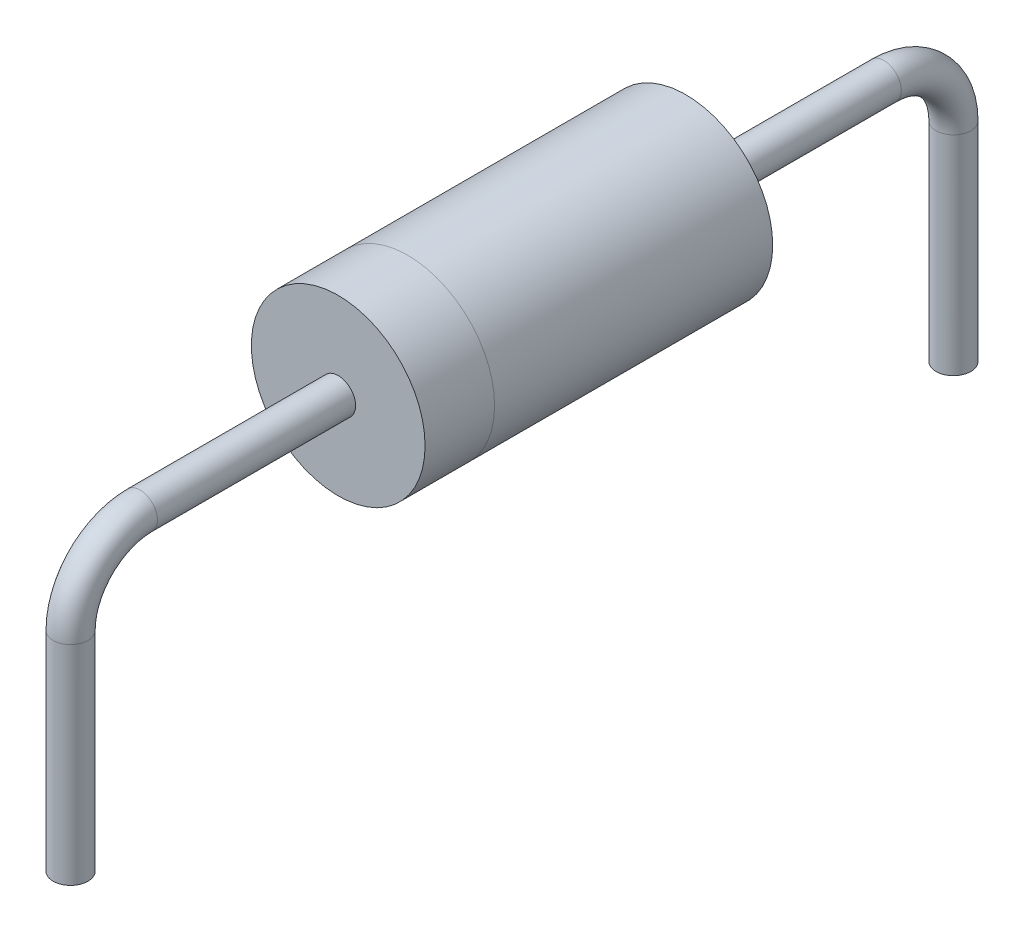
SolidWorks part; units mm, degrees
ref_plane "Plan de face" through (0, 0, 0) normal (0, 0, 1) x (1, 0, 0)
ref_plane "Plan de dessus" through (0, 0, 0) normal (0, 1, 0) x (1, 0, 0)
ref_plane "Plan de droite" through (0, 0, 0) normal (1, 0, 0) x (0, 0, -1)
sketch "Esquisse1" plane through (0, 0, 0) normal (0, 0, 1) x (1, 0, 0)
  circle A0 centre (0, 0) radius 1.25
  dimension "D1" = 2.5
extrude "Boss.-Extru.1" add sketch "Esquisse1" along normal blind 4
sketch "Esquisse2" plane through (0, 0, 4) normal (0, 0, 1) x (1, 0, 0)
  circle A0 centre (0, 0) radius 1.2495
  dimension "D1" = 2.499
extrude "Boss.-Extru.2" add sketch "Esquisse2" along normal blind 1
ref_plane "Plan1" through (0, 0, 5) normal (0, 0, 1) x (1, 0, 0)
sketch "Esquisse3" plane through (0, 0, 0) normal (1, 0, 0) x (0, 0, -1)
  line L0 (-5, 0) -> (-7.85, 0)
  line L1 (-5, 1.3744) -> (-5, -1.3744) construction
  line L2 (-8.85, -1) -> (-8.85, -4)
  arc A0 (-7.85, 0) -> (-8.85, -1) centre (-7.85, -1) ccw
  point P8 (-8.85, 0)
  dimension "D3" = 1
  dimension "D1" = 3.85
  dimension "D2" = 4
sketch "Esquisse4" plane through (0, 0, 5) normal (0, 0, 1) x (1, 0, 0)
  circle A0 centre (0, 0) radius 0.25
  dimension "D1" = 0.5
sweep "Balayage1" add profiles "Esquisse4" path "Esquisse3"
ref_plane "Plan2" through (0, 0, 2.5) normal (0, 0, 1) x (1, 0, 0)
mirror "Symétrie1" about plane through (0, 0, 2.5) normal (0, 0, 1) of "Balayage1"
